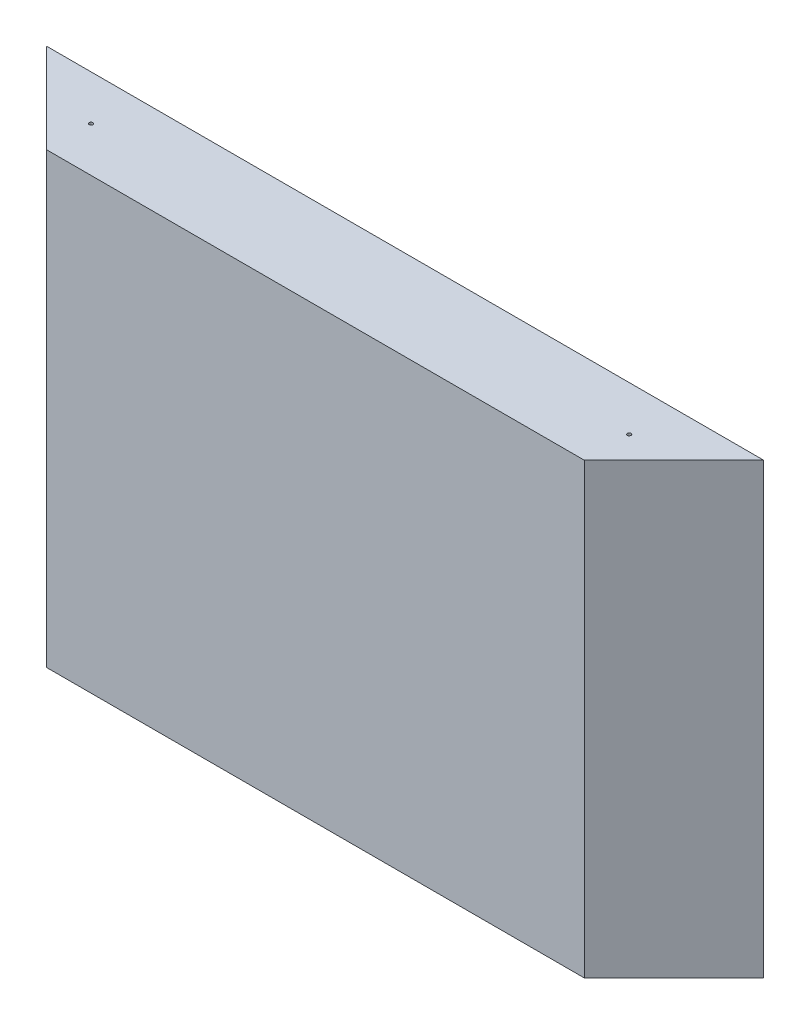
SolidWorks part; units mm, degrees
ref_plane "Front Plane" through (0, 0, 0) normal (0, 0, 1) x (1, 0, 0)
ref_plane "Top Plane" through (0, 0, 0) normal (0, 1, 0) x (1, 0, 0)
ref_plane "Right Plane" through (0, 0, 0) normal (1, 0, 0) x (0, 0, -1)
sketch "Sketch1" plane through (0, 0, 0) normal (0, 0, 1) x (1, 0, 0)
  line L1 (-152.4, -95.25) -> (152.4, -95.25)
  line L2 (-152.4, -95.25) -> (-152.4, 95.25)
  line L3 (-152.4, 95.25) -> (152.4, 95.25)
  line L4 (152.4, -95.25) -> (152.4, 95.25)
  line L5 (-152.4, -95.25) -> (152.4, 95.25) construction
  line L6 (-152.4, 95.25) -> (152.4, -95.25) construction
  point P0 (0, 0)
  dimension "D1" = 304.8
  dimension "D2" = 190.5
extrude "Boss-Extrude1" add sketch "Sketch1" along normal blind 38.1
hole_wizard "1/16 (0.0625) Diameter Hole1" positions "Sketch10" profile "Sketch11" hole size "1/16" standard "ANSI Inch"
sketch "Sketch10" plane through (0, -95.25, 0) normal (0, -1, 0) x (-1, 0, 0)
  line L0 (152.4, 0) -> (-152.4, 0) construction
  line L1 (152.4, -38.1) -> (152.4, 0) construction
  point P0 (101.6, -19.05)
  point P2 (-101.6, -19.05)
  dimension "D1" = 50.8
  dimension "D2" = 19.05
  dimension "D3" = 50.8
  dimension "D4" = 203.2
sketch "Sketch11" plane through (-101.6, -95.25, 19.05) normal (1, 0, 0) x (0, 0, -1)
  line L0 (0, 0) -> (0, 51.2769)
  line L1 (0, 51.2769) -> (0.7937, 50.8)
  line L2 (0.7937, 50.8) -> (0.7937, 0)
  line L5 (0.7937, 0) -> (0, 0)
  line L10 (0, 51.2769) -> (-0.7938, 50.8) construction
  line L11 (0, -6.35) -> (0, 107.95) construction
  dimension "Hole Dia." = 1.5875
  dimension "Hole Depth" = 50.8
  dimension "Drill Angle" = 118
hole_wizard "1/16 (0.0625) Diameter Hole3" positions "Sketch16" profile "Sketch17" hole size "1/16" standard "ANSI Inch"
sketch "Sketch16" plane through (0, 95.25, 0) normal (0, 1, 0) x (1, 0, 0)
  line L0 (-152.4, -38.1) -> (-152.4, 0) construction
  line L1 (152.4, 0) -> (-152.4, 0) construction
  point P0 (-114.3, -19.05)
  point P8 (114.3, -19.05)
  dimension "D1" = 38.1
  dimension "D2" = 19.05
  dimension "D3" = 38.1
sketch "Sketch17" plane through (-114.3, 95.25, 19.05) normal (1, 0, 0) x (0, 0, 1)
  line L0 (0, 0) -> (0, 25.8769)
  line L1 (0, 25.8769) -> (0.7937, 25.4)
  line L2 (0.7937, 25.4) -> (0.7937, 0)
  line L5 (0.7937, 0) -> (0, 0)
  line L10 (0, 25.8769) -> (-0.7938, 25.4) construction
  line L11 (0, -6.35) -> (0, 107.95) construction
  dimension "Hole Dia." = 1.5875
  dimension "Hole Depth" = 25.4
  dimension "Drill Angle" = 118
chamfer "Chamfer1" distance 38.1 angle 45 2 edges at (152.4, 0, 38.1) (-152.4, 0, 38.1)
